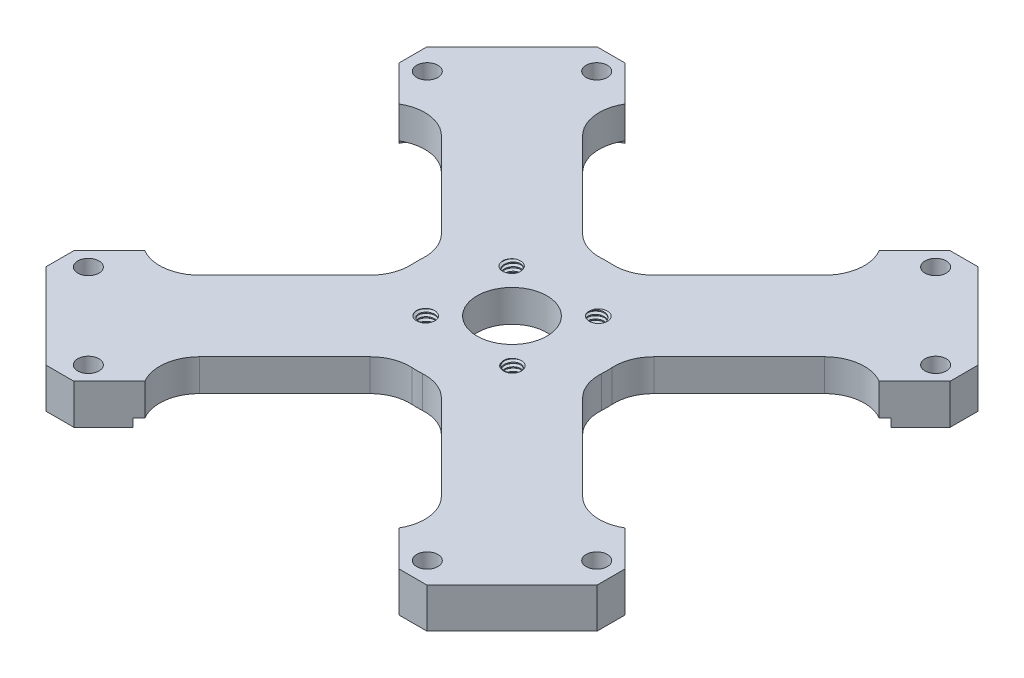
SolidWorks part; units mm, degrees
ref_plane "Front" through (0, 0, 0) normal (0, 0, 1) x (1, 0, 0)
ref_plane "Top" through (0, 0, 0) normal (0, 1, 0) x (1, 0, 0)
ref_plane "Right" through (0, 0, 0) normal (1, 0, 0) x (0, 0, -1)
sketch "layout" plane through (0, 0, 0) normal (0, 1, 0) x (1, 0, 0)
  line L0 (0, 0) -> (207.5259, 0) construction
  line L4 (101.6, 101.6) -> (101.6, 0)
  line L5 (101.6, 101.6) -> (0, 0) construction
  line L6 (0, 0) -> (0, 139.8437) construction
  line L7 (0, 0) -> (22.3724, -22.3724) construction
  line L8 (46.5742, 101.6) -> (101.6, 46.5742)
  line L9 (48.0444, 59.7187) -> (59.7187, 48.0444) construction
  line L10 (21.1036, 32.7779) -> (32.7779, 21.1036) construction
  line L11 (60.5442, 87.63) -> (51.709, 87.63)
  line L12 (51.709, 87.63) -> (0, 35.921)
  line L13 (53.8815, 80.8223) -> (80.8223, 53.8815) construction
  line L14 (0, 0) -> (0, 101.6)
  line L15 (0, 0) -> (101.6, 0)
  line L16 (0, 101.6) -> (101.6, 101.6)
  line L17 (87.63, 60.5442) -> (87.63, 51.709)
  line L18 (87.63, 51.709) -> (35.921, 0)
  line L19 (0, 35.921) -> (35.921, 0) construction
  arc A0 (11.1125, 0) -> (0, 11.1125) centre (0, 0) ccw
  arc A2 (88.9, 0) -> (0, 88.9) centre (0, 0) ccw
  point P17 (26.9408, 26.9408)
  point P20 (74.0871, 74.0871)
  point P21 (53.8815, 53.8815)
  point P22 (13.4704, 13.4704)
  point P26 (17.9605, 17.9605)
  point P29 (67.3519, 67.3519)
  dimension "D1" = 203.2
  dimension "D2" = 22.225
  dimension "D3" = 177.8
  dimension "D4" = 209.55
  dimension "D5" = 38.1
  dimension "D6" = 190.5
  dimension "D7" = 38.1
  dimension "D8" = 38.1
  dimension "D9" = 16.51
  dimension "D10" = 38.1
  dimension "D11" = 13.97
  dimension "D12" = 13.97
  dimension "D13" = 50.8
sketch "Sketch2" plane through (0, 0, 0) normal (0, 1, 0) x (1, 0, 0)
  line L2 (0, 0) -> (101.6, 0) construction
  line L3 (0, 0) -> (0, 101.6) construction
  line L6 (0, 0) -> (35.921, 0)
  line L7 (0, 0) -> (0, 35.921)
  line L8 (46.5742, 101.6) -> (101.6, 46.5742) construction
  line L9 (60.5442, 87.63) -> (87.63, 60.5442)
  line L10 (87.63, 51.709) -> (35.921, 0) construction
  line L11 (87.63, 60.5442) -> (87.63, 51.709) construction
  line L12 (51.709, 87.63) -> (0, 35.921) construction
  line L13 (60.5442, 87.63) -> (51.709, 87.63) construction
  line L14 (87.63, 51.709) -> (35.921, 0)
  line L15 (87.63, 60.5442) -> (87.63, 51.709)
  line L16 (51.709, 87.63) -> (0, 35.921)
  line L17 (60.5442, 87.63) -> (51.709, 87.63)
extrude "Boss-Extrude1" add sketch "Sketch2" along normal blind 12.7
sketch "Sketch3" plane through (0, 0, 0) normal (0, 1, 0) x (1, 0, 0)
  line L0 (0, 88.9) -> (0, 0)
  line L1 (0, 0) -> (88.9, 0)
  arc A0 (88.9, 0) -> (0, 88.9) centre (0, 0) ccw construction
  arc A1 (88.9, 0) -> (0, 88.9) centre (0, 0) ccw
extrude "Cut-Extrude1" cut sketch "Sketch3" along normal blind 2.54
sketch "Sketch4" plane through (0, 0, 0) normal (0, 1, 0) x (1, 0, 0)
  circle A0 centre (0, 0) radius 11.1125
extrude "Cut-Extrude2" cut sketch "Sketch4" along normal through all
sketch "Sketch5" plane through (0, 0, 0) normal (0, 1, 0) x (1, 0, 0)
  line L0 (47.1463, 69.597) -> (6.9097, 29.3604)
  line L1 (29.3604, 6.9097) -> (69.597, 47.1463)
  line L2 (101.6, 101.6) -> (0, 0) construction
  line L3 (27.028, 49.4787) -> (49.4787, 27.028) construction
  line L4 (0, 30.1625) -> (0, 116.7433)
  line L5 (30.1625, 0) -> (116.7433, 0)
  line L6 (47.1463, 69.597) -> (0, 116.7433)
  line L7 (69.597, 47.1463) -> (116.7433, 0)
  line L8 (-141421.3562, 141421.3562) -> (141443.7286, -141443.7286) construction
  arc A4 (6.9097, 29.3604) -> (0, 30.1625) centre (0, 0) ccw
  arc A5 (30.1625, 0) -> (0, 30.1625) centre (0, 0) ccw
  arc A6 (30.1625, 0) -> (29.3604, 6.9097) centre (0, 0) ccw
  point P14 (38.2534, 38.2534)
  dimension "D3" = 31.75
  dimension "D1" = 82.55
  dimension "D2" = 19.05
extrude "Cut-Extrude3" cut sketch "Sketch5" along normal through all
fillet "Fillet1" radius 12.7 4 edges at (6.9097, 7.62, -29.3604) (47.1463, 7.62, -69.597) (29.3604, 7.62, -6.9097) (69.597, 7.62, -47.1463)
sketch "Sketch6" plane through (0, 12.7, 0) normal (0, 1, 0) x (1, 0, 0)
  point P0 (53.8815, 80.8223)
  point P3 (80.8223, 53.8815)
hole_wizard "1/4 Clearance Hole1" positions "Sketch6" profile "Sketch7" hole size "1/4" standard "ANSI Inch"
sketch "Sketch7" plane through (53.8815, 12.7, -80.8223) normal (1, 0, 0) x (0, 0, 1)
  line L0 (0, 0) -> (0, 12.7)
  line L1 (0, 12.7) -> (3.3782, 12.7)
  line L2 (3.3782, 12.7) -> (3.3782, 0)
  line L5 (3.3782, 0) -> (0, 0)
  line L11 (0, -6.35) -> (0, 107.95) construction
  dimension "Thru Hole Dia." = 6.7564
  dimension "Thru Hole Depth" = 12.7
sketch "Sketch8" plane through (0, 2.54, 0) normal (0, -1, 0) x (-1, 0, 0)
  point P0 (-59.7187, 48.0444)
  point P3 (-48.0444, 59.7187)
  point P6 (-21.1036, 32.7779)
  point P9 (-32.7779, 21.1036)
hole_wizard "21/64 (0.32813) Diameter Hole1" positions "Sketch8" profile "Sketch9" hole size "21/64" standard "ANSI Inch"
sketch "Sketch9" plane through (59.7187, 2.54, -48.0444) normal (1, 0, 0) x (0, 0, -1)
  line L0 (0, 0) -> (0, 0.762)
  line L1 (0, 0.762) -> (4.1673, 0.762)
  line L2 (4.1673, 0.762) -> (4.1673, 0)
  line L5 (4.1673, 0) -> (0, 0)
  line L10 (0, 0.762) -> (-4.1673, 0.762) construction
  line L11 (0, -6.35) -> (0, 107.95) construction
  dimension "Hole Dia." = 8.3345
  dimension "Hole Depth" = 0.762
  dimension "Drill Angle" = 180
sketch "Sketch10" plane through (0, 12.7, 0) normal (0, 1, 0) x (1, 0, 0)
  point P0 (13.4704, 13.4704)
hole_wizard "1/4-20 Tapped Hole1" positions "Sketch10" profile "Sketch11" tap size "1/4-20" standard "ANSI Inch"
sketch "Sketch11" plane through (13.4704, 12.7, -13.4704) normal (1, 0, 0) x (0, 0, 1)
  line L0 (0, 0) -> (0, 12.7)
  line L1 (0, 12.7) -> (2.5527, 12.7)
  line L2 (2.5527, 12.7) -> (2.5527, 0)
  line L5 (2.5527, 0) -> (0, 0)
  line L11 (0, -6.35) -> (0, 107.95) construction
  dimension "Thru Tap Drill Dia." = 5.1054
  dimension "Thru Tap Drill Depth" = 12.7
ref_plane "Plane1" through (0, 0, 0) normal (-0.7071, 0, -0.7071) x (-0.7071, 0, 0.7071)
sketch "Sketch12" plane through (0, 0, 0) normal (-0.7071, 0, -0.7071) x (-0.7071, 0, 0.7071)
  line L0 (-76.2, 2.54) -> (-84.9988, 7.62)
  line L1 (-76.2, 2.54) -> (-38.1, 2.54) construction
  line L2 (-38.1, 2.54) -> (-29.3012, 7.62)
  line L3 (-21.6027, 2.54) -> (-16.4973, 2.54) construction
  line L4 (-84.9988, 7.62) -> (-85.5068, 6.7401)
  line L5 (-85.5068, 6.7401) -> (-76.708, 1.6601)
  line L6 (-76.708, 1.6601) -> (-76.2, 2.54)
  line L7 (-29.3012, 7.62) -> (-28.7932, 6.7401)
  line L8 (-28.7932, 6.7401) -> (-37.592, 1.6601)
  line L9 (-37.592, 1.6601) -> (-38.1, 2.54)
  spline S0 degree 3 poles (-76.2, 2.54) (-68.8677, -1.6933) (-45.4323, -1.6933) (-38.1, 2.54) knots 0 0 0 0 1 1 1 1 construction
  point P11 (-30.4925, 8.8728)
  point P13 (-39.379, 4.663)
  point P14 (-82.4034, 8.8728)
  point P15 (-83.2318, 9.5695)
  point P16 (0, 0)
  point P17 (-82.9138, 11.2313)
  point P18 (-74.5826, 5.3414)
  point P19 (-75.6051, 3.5704)
  point P20 (-41.8878, 5.0497)
  point P21 (-29.1022, 10.4488)
  point P22 (0, 0)
  point P23 (0, 0)
  point P24 (0, 0)
  point P25 (0, 0)
  point P26 (-31.0329, 10.5233)
  point P27 (0, 0)
  point P28 (0, 0)
  point P29 (0, 0)
  point P30 (-30.1752, 8.9885)
  point P31 (-38.9227, 3.8727)
  dimension "D4" = 59.2743
  dimension "D5" = 25.4
  dimension "D6" = 25.4
  dimension "D1" = 10.16
  dimension "D2" = 30
  dimension "D3" = 30
  dimension "D7" = 1.016
extrude "Cut-Extrude4" cut sketch "Sketch12" against normal mid plane 19.05
sketch "Sketch14" plane through (0, 0, 0) normal (0, 1, 0) x (1, 0, 0)
  line L0 (58.3717, 76.3322) -> (8.9803, 26.9408)
  line L1 (53.8815, 80.8223) -> (80.8223, 53.8815) construction
  line L2 (0, 35.921) -> (35.921, 0) construction
  line L3 (8.9803, 26.9408) -> (26.9408, 8.9803)
  line L4 (26.9408, 8.9803) -> (76.3322, 58.3717)
  line L5 (76.3322, 58.3717) -> (58.3717, 76.3322)
  line L6 (101.6, 101.6) -> (0, 0) construction
  point P6 (17.9605, 17.9605)
  dimension "D1" = 25.4
extrude "Cut-Extrude5" [suppressed] cut sketch "Sketch14" against normal through all both and the other way through all flip side to cut
sketch "Sketch16" [suppressed] plane through (8.9803, 0, 8.9803) normal (0.7071, 0, 0.7071) x (0.7071, 0, -0.7071)
  line L1 (22.7622, 19.7655) -> (106.4176, 19.7655)
  line L2 (22.7622, 19.7655) -> (22.7622, -5.802)
  line L3 (22.7622, -5.802) -> (106.4176, -5.802)
  line L4 (106.4176, 19.7655) -> (106.4176, -5.802)
extrude "Cut-Extrude6" [suppressed] cut sketch "Sketch16" against normal up to surface and the other way through all
sketch "Sketch18" [suppressed] plane through (6.7352, 0, 6.7352) normal (0.7071, 0, 0.7071) x (0.7071, 0, -0.7071)
  line L0 (43.7902, 5.5601) -> (81.8902, 5.5601) construction
  text T0 "Spring test V1" font "Century Gothic" height 3.175
  dimension "D1" = 38.1
extrude "Cut-Extrude7" [suppressed] cut sketch "Sketch18" against normal blind 1.27
thread "Thread1" pitch 1.27 start angle 0, offset 1, length 0, pitch 1.27, diameter 5.1054
ref_plane "Plane2" through (10.9177, 13.7, -13.4704) normal (0, 0, 1) x (-1, 0, 0)
sketch "Thread Profile1" plane through (10.9177, 13.7, -13.4704) normal (0, 0, 1) x (-1, 0, 0)
  line L0 (0, 0) -> (0, 1.27) construction
  line L1 (0, 0) -> (0.6874, 0.3969)
  line L2 (0.6874, 0.3969) -> (0.6874, 0.5556)
  line L3 (0.6874, 0.5556) -> (0, 0.9525)
  line L4 (0.6874, 0.4762) -> (0, 0.4762) construction
  line L11 (0, 0) -> (0, 0.9525)
  point P2 (0, 0)
  dimension "Pitch" = 1.27
  dimension "Profile_Angle" = 60
  dimension "Profile_Land" = 0.1588
  dimension "Profile_Height" = 0.6874
mirror "Mirror1" about plane through (0, 0, 0) normal (1, 0, 0)
